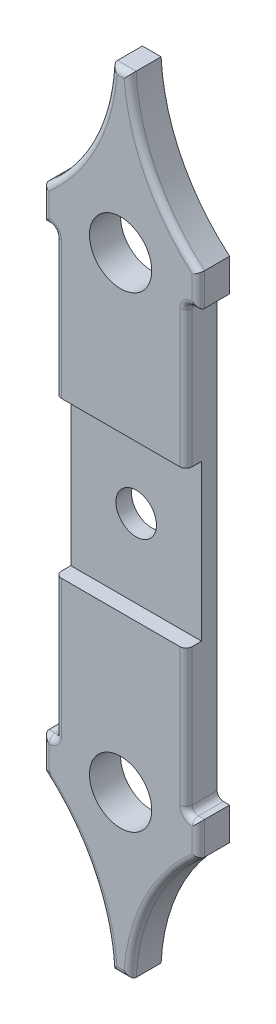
SolidWorks part; units mm, degrees
ref_plane "Front Plane" through (0, 0, 0) normal (0, 0, 1) x (1, 0, 0)
ref_plane "Top Plane" through (0, 0, 0) normal (0, 1, 0) x (1, 0, 0)
ref_plane "Right Plane" through (0, 0, 0) normal (1, 0, 0) x (0, 0, -1)
sketch "Sketch1" plane through (0, 0, 0) normal (0, 0, 1) x (1, 0, 0)
  line L0 (25, -196.0637) -> (21, -196.0637)
  line L1 (-21, -53.9363) -> (-25, -53.9363)
  line L2 (25, -53.9363) -> (25, -43.4663)
  line L3 (3, 1) -> (-3, 1)
  line L4 (-25, -53.9363) -> (-25, -43.4663)
  line L5 (-25, -196.0637) -> (-25, -206.5337)
  line L6 (3, -251) -> (-3, -251)
  line L7 (25, -53.9363) -> (21, -53.9363)
  line L8 (25, -196.0637) -> (25, -206.5337)
  line L9 (-21, -196.0637) -> (-25, -196.0637)
  line L15 (-21, -196.0637) -> (-21, -53.9363)
  line L18 (21, -196.0637) -> (21, -53.9363)
  arc A0 (3, 1) -> (25, -43.4663) centre (65.4177, 4.2061) ccw
  arc A1 (-3, 1) -> (-25, -43.4663) centre (-65.4177, 4.2061) cw
  arc A2 (-3, -251) -> (-25, -206.5337) centre (-65.4177, -254.2061) ccw
  arc A3 (3, -251) -> (25, -206.5337) centre (65.4177, -254.2061) cw
  point P0 (0, 0)
  point P4 (21, -125)
  point P11 (0, 1)
  point P15 (-21, -125)
  point P16 (-21, -125)
  point P18 (21, -125)
  point P29 (0, -251)
  point P30 (0, -250)
  dimension "D5" = 62.5
  dimension "D3" = 6
extrude "Boss-Extrude1" add sketch "Sketch1" along normal blind 5
sketch "Sketch2" plane through (0, 0, 5) normal (0, 0, 1) x (1, 0, 0)
  line L0 (-21, -100) -> (21, -100)
  line L1 (-21, -53.9363) -> (-21, -196.0637) construction
  line L2 (21, -196.0637) -> (21, -53.9363) construction
  line L3 (-21, -53.9363) -> (-21, -196.0637) construction
  line L4 (25, -53.9363) -> (25, -43.4663) construction
  line L5 (-25, -43.4663) -> (-25, -53.9363) construction
  line L6 (-25, -53.9363) -> (-21, -53.9363) construction
  line L7 (21, -53.9363) -> (25, -53.9363) construction
  line L8 (25, -53.9363) -> (25, -43.4663)
  line L9 (21, -100) -> (21, -53.9363)
  line L10 (-21, -53.9363) -> (-21, -100)
  line L11 (-25, -43.4663) -> (-25, -53.9363)
  line L12 (-25, -53.9363) -> (-21, -53.9363)
  line L13 (21, -53.9363) -> (25, -53.9363)
  line L14 (3, 1) -> (-3, 1) construction
  line L15 (21, -196.0637) -> (25, -196.0637)
  line L16 (-25, -196.0637) -> (-21, -196.0637)
  line L17 (-25, -206.5337) -> (-25, -196.0637)
  line L18 (-21, -196.0637) -> (-21, -150)
  line L19 (21, -150) -> (21, -196.0637)
  line L20 (25, -196.0637) -> (25, -206.5337)
  line L21 (-21, -150) -> (21, -150)
  line L22 (-3, -251) -> (3, -251) construction
  line L23 (3, 1) -> (-3, 1)
  line L24 (-3, -251) -> (3, -251)
  arc A0 (-25, -43.4663) -> (-3, 1) centre (-65.4177, 4.2061) ccw construction
  arc A1 (3, 1) -> (25, -43.4663) centre (65.4177, 4.2061) ccw construction
  arc A2 (-25, -43.4663) -> (-3, 1) centre (-65.4177, 4.2061) ccw
  arc A3 (3, 1) -> (25, -43.4663) centre (65.4177, 4.2061) ccw
  arc A4 (3, -251) -> (25, -206.5337) centre (65.4177, -254.2061) cw
  arc A5 (-25, -206.5337) -> (-3, -251) centre (-65.4177, -254.2061) cw
  point P6 (-21, -125)
  dimension "D1" = 25
extrude "Boss-Extrude2" add sketch "Sketch2" along normal blind 5
sketch "Sketch4" plane through (0, 0, 10) normal (0, 0, 1) x (1, 0, 0)
  circle A0 centre (0, -50) radius 10
  circle A1 centre (0, -125) radius 6.5
  circle A2 centre (0, -200) radius 10
  dimension "D1" = 20
  dimension "D2" = 13
  dimension "D3" = 20
  dimension "D5" = 75
  dimension "D6" = 75
extrude "Cut-Extrude1" cut sketch "Sketch4" against normal blind 116
fillet "Fillet1" radius 2 22 edges at (21, -173.0318, 10) (23, -196.0637, 10) (25, -201.2987, 10) (9.399, -226.4905, 10) (0, -251, 10) (-9.399, -226.4905, 10) (-25, -201.2987, 10) (-23, -196.0637, 10) (-21, -173.0318, 10) (-23, -53.9363, 10) (-25, -48.7013, 10) (-9.399, -23.5095, 10) (0, 1, 10) (9.399, -23.5095, 10) (25, -48.7013, 10) (23, -53.9363, 10) (21, -76.9682, 10) (-21, -76.9682, 10) (-21, -196.0637, 5) (21, -196.0637, 5) (21, -53.9363, 5) (-21, -53.9363, 5)
